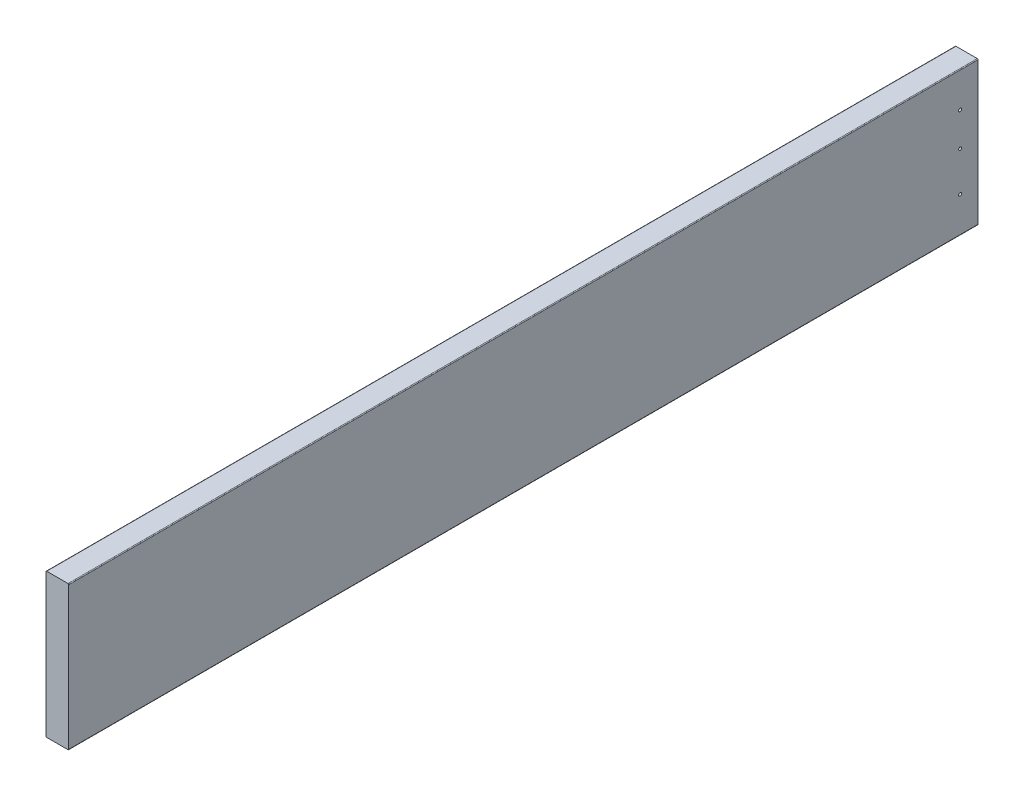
SolidWorks part; units mm, degrees
ref_plane "Front" through (0, 0, 0) normal (0, 0, 1) x (1, 0, 0)
ref_plane "Top" through (0, 0, 0) normal (0, 1, 0) x (1, 0, 0)
ref_plane "Right" through (0, 0, 0) normal (1, 0, 0) x (0, 0, -1)
sketch "Sketch1" plane through (0, 0, 0) normal (0, 0, 1) x (1, 0, 0)
  line L1 (-19.05, -120.65) -> (19.05, -120.65)
  line L2 (-19.05, -120.65) -> (-19.05, 120.65)
  line L3 (-19.05, 120.65) -> (19.05, 120.65)
  line L4 (19.05, -120.65) -> (19.05, 120.65)
  line L5 (-19.05, -120.65) -> (19.05, 120.65) construction
  line L6 (-19.05, 120.65) -> (19.05, -120.65) construction
  point P0 (0, 0)
  dimension "D1" = 241.3
  dimension "D2" = 38.1
extrude "Extrude1" add sketch "Sketch1" along normal blind 1524
fillet "Fillet1" radius 1.27 4 edges at (-19.05, -120.65, 762) (19.05, -120.65, 762) (19.05, 120.65, 762) (-19.05, 120.65, 762)
sketch "Sketch2" plane through (19.05, 0, 0) normal (1, 0, 0) x (0, 0, -1)
  line L0 (0, -119.38) -> (0, 119.38) construction
  line L1 (-1524, -119.38) -> (0, -119.38) construction
  circle A3 centre (-30, -60.8542) radius 2.5
  circle A4 centre (-30, 5.3958) radius 2.5
  circle A5 centre (-30, 61.6458) radius 2.5
  dimension "D1" = 5
  dimension "D2" = 30
  dimension "D3" = 58.5258
  dimension "D4" = 124.7758
  dimension "D5" = 181.0258
extrude "Cut-Extrude1" cut sketch "Sketch2" against normal blind 17.78
sketch "Sketch3" plane through (-19.05, 0, 0) normal (-1, 0, 0) x (0, 0, 1)
  line L0 (0, 119.38) -> (0, -119.38) construction
  line L1 (0, -119.38) -> (1524, -119.38) construction
  circle A3 centre (30, -60.8542) radius 2.5
  circle A4 centre (30, 5.3958) radius 2.5
  circle A5 centre (30, 61.6458) radius 2.5
  dimension "D1" = 5
  dimension "D2" = 30
  dimension "D3" = 59.7958
  dimension "D4" = 126.0458
  dimension "D5" = 182.2958
extrude "Cut-Extrude2" cut sketch "Sketch3" against normal blind 17.78
